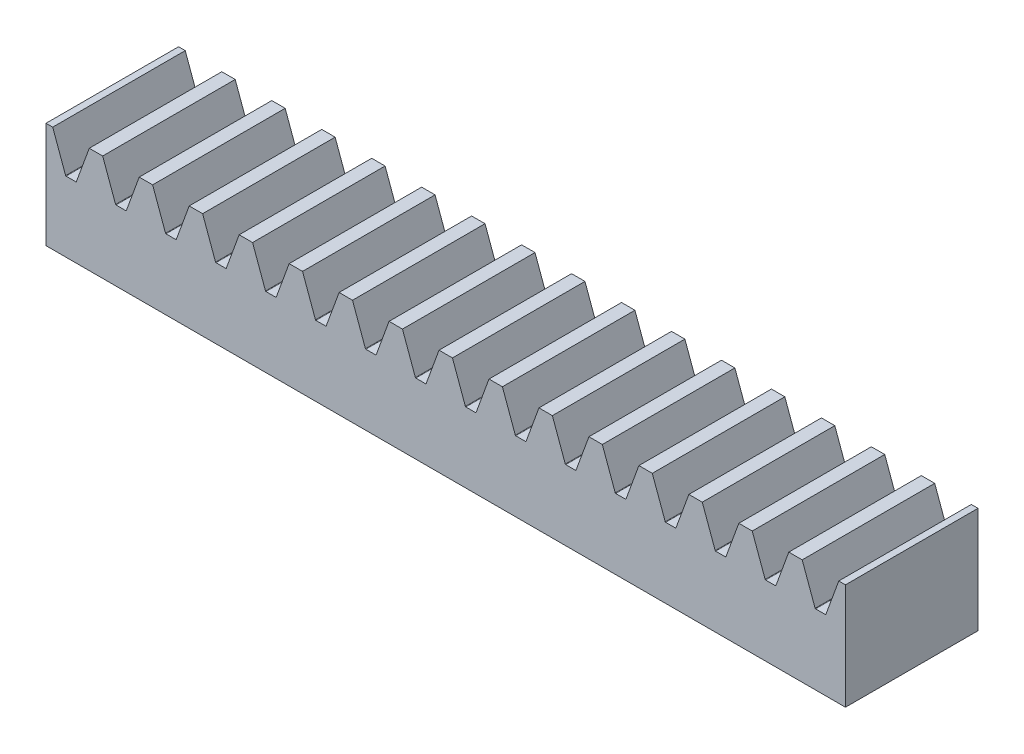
SolidWorks part; units mm, degrees
ref_plane "正面" through (0, 0, 0) normal (0, 0, 1) x (1, 0, 0)
ref_plane "平面" through (0, 0, 0) normal (0, 1, 0) x (1, 0, 0)
ref_plane "右側面" through (0, 0, 0) normal (1, 0, 0) x (0, 0, -1)
sketch "ｽｹｯﾁ1" plane through (0, 0, 0) normal (0, 0, 1) x (1, 0, 0)
  line L1 (0, 0) -> (18.8496, 0)
  line L2 (0, 0) -> (0, 40)
  line L3 (0, 40) -> (18.8496, 40)
  line L4 (18.8496, 0) -> (18.8496, 40)
extrude "ﾎﾞｽ - 押し出し1" add sketch "ｽｹｯﾁ1" against normal blind 50
sketch "ｽｹｯﾁ2" plane through (0, 0, 0) normal (0, 0, 1) x (1, 0, 0)
  line L0 (2.5286, 40) -> (7.4422, 26.5)
  line L1 (18.8496, 40) -> (0, 40) construction
  line L2 (7.4422, 26.5) -> (11.4074, 26.5)
  line L3 (11.4074, 26.5) -> (16.321, 40)
  line L4 (16.321, 40) -> (2.5286, 40)
  line L5 (0, 40) -> (0, 0) construction
  line L6 (18.8496, 0) -> (18.8496, 40) construction
  line L7 (-32.432, 34) -> (-29.2848, 34) construction
  point P10 (4.7124, 34)
  point P11 (14.1372, 34)
  point P13 (0.7135, 40)
extrude "ｶｯﾄ - 押し出し1" cut sketch "ｽｹｯﾁ2" against normal through all
fillet "ﾌｨﾚｯﾄ1" radius 0.2 2 edges at (7.4422, 26.5, -25) (11.4074, 26.5, -25)
pattern_linear "直線ﾊﾟﾀｰﾝ3" count 16 spacing 18.8496 along (1, 0, 0) of "ﾎﾞｽ - 押し出し1", "ｶｯﾄ - 押し出し1", "ﾌｨﾚｯﾄ1"
equation "\"歯幅\"= 50"
equation "\"歯数\" = 16"
equation "\"圧力角\"= 20'変更禁止"
equation "\"モジュール\"= 6"
equation "\"D1@ｽｹｯﾁ2\"=\"圧力角\""
equation "\"D2@ｽｹｯﾁ2\"=\"圧力角\""
equation "\"歯たけ\"= 2.25 * \"モジュール\"'変更禁止"
equation "\"D3@ｽｹｯﾁ2\"=\"歯たけ\""
equation "\"従動ピッチ\"= ( pi * \"モジュール\" ) / 2'変更禁止"
equation "\"D4@ｽｹｯﾁ2\"=\"従動ピッチ\""
equation "\"歯末\"= 1.00 * \"モジュール\"'変更禁止"
equation "\"D5@ｽｹｯﾁ2\"=\"歯末\""
equation "\"ピッチ\"= \"従動ピッチ\" / 2'変更禁止"
equation "\"D6@ｽｹｯﾁ2\"=\"ピッチ\""
equation "\"基準ピッチ\"= \"従動ピッチ\" * 2'変更禁止"
equation "\"フィレット\"= 0.2"
equation "\"D1@ﾌｨﾚｯﾄ1\"=\"フィレット\""
equation "\"D1@ｽｹｯﾁ1\"=\"基準ピッチ\""
equation "\"D3@直線ﾊﾟﾀｰﾝ3\"=\"基準ピッチ\""
equation "\"D1@直線ﾊﾟﾀｰﾝ3\"=\"歯数\""
equation "\"D1@ﾎﾞｽ - 押し出し1\"=\"歯幅\""
